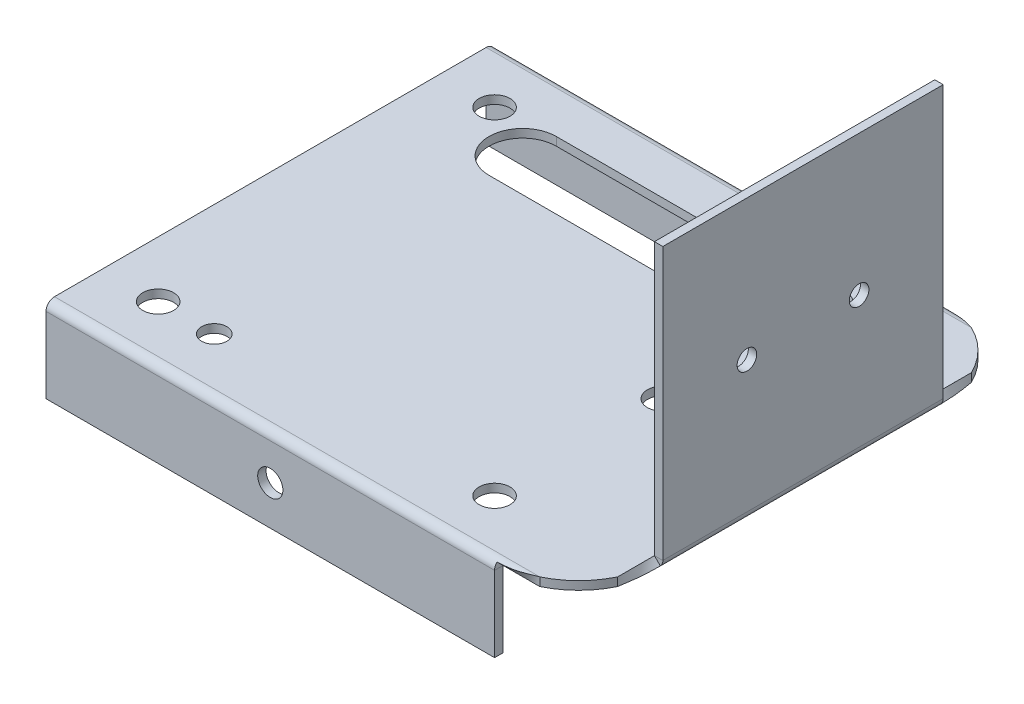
SolidWorks part; units mm, degrees
ref_plane "Front" through (0, 0, 0) normal (0, 0, 1) x (1, 0, 0)
ref_plane "Top" through (0, 0, 0) normal (0, 1, 0) x (1, 0, 0)
ref_plane "Right" through (0, 0, 0) normal (1, 0, 0) x (0, 0, -1)
sketch "Sketch1" plane through (0, 0, 0) normal (0, 1, 0) x (1, 0, 0)
  line L0 (20, 31) -> (55, 31)
  line L1 (0, 55) -> (0, -55)
  line L2 (0, 55) -> (80, 55)
  line L3 (80, 55) -> (80, 40)
  line L5 (80, -55) -> (80, -40)
  line L6 (0, -55) -> (80, -55)
  line L7 (145, 0) -> (145, 25)
  line L8 (145, 25) -> (95, 25)
  line L9 (145, 0) -> (145, -25)
  line L10 (145, -25) -> (95, -25)
  line L16 (20, 19) -> (55, 19)
  arc A0 (95, 25) -> (80, 40) centre (80, 25) ccw
  arc A1 (95, -25) -> (80, -40) centre (80, -25) cw
  circle A2 centre (40, 48) radius 2.25
  circle A3 centre (40, -48) radius 2.25
  circle A4 centre (120, 10) radius 1.75
  circle A5 centre (120, -10) radius 1.75
  circle A6 centre (10, 30) radius 2.75
  circle A7 centre (10, -30) radius 2.75
  arc A8 (20, 31) -> (20, 19) centre (20, 25) ccw
  arc A9 (55, 19) -> (55, 31) centre (55, 25) ccw
  circle A11 centre (20, -30) radius 2.25
  circle A12 centre (70, 30) radius 2.75
  circle A13 centre (70, 0) radius 2.75
  circle A14 centre (70, -30) radius 2.75
  dimension "D3" = 80
  dimension "D4" = 15
sheet metal parameters "Sheet-Metal1" thickness 1.5 parameters "D1"=0.01
base flange "Base-Flange1" sketch "Sketch1" thickness 1.5 reverse thickness direction yes parameters "D1"=0.01
sketch "Sketch2" plane through (0, 1.5, 0) normal (0, 1, 0) x (-1, 0, 0)
  line L0 (-95, -25) -> (-95, 25)
sketched bend "Sketched Bend1" parameters "D1"=0.01
bend "SketchBend1" bend radius 0.01 bend angle 90 parameters "D5"=1
sketch "Sketch3" plane through (0, 1.5, 0) normal (0, 1, 0) x (-1, 0, 0)
  line L0 (-80, -40) -> (0, -40)
  line L1 (0, -55) -> (0, 55) construction
  line L2 (-80, 40) -> (0, 40)
sketched bend "Sketched Bend2" parameters "D1"=0
bend "SketchBend2" bend radius 0.01 bend angle 90 parameters "D5"=2
bend "SketchBend3" bend radius 0 bend angle 90 parameters "D5"=3
flat pattern "Flat-Pattern1"
sketch "Bend-Lines1" plane through (0, 1.5, 0) normal (0, 1, 0) x (-1, 0, 0)
  line L0 (0, 40) -> (-80, 40) construction
  line L1 (0, -40) -> (-80, -40) construction
  line L2 (-95, 25) -> (-95, -25) construction
bend of the flat pattern "Flatten-<SketchBend1>1"
bend of the flat pattern "Flatten-<SketchBend2>1"
bend of the flat pattern "Flatten-<SketchBend3>1"
